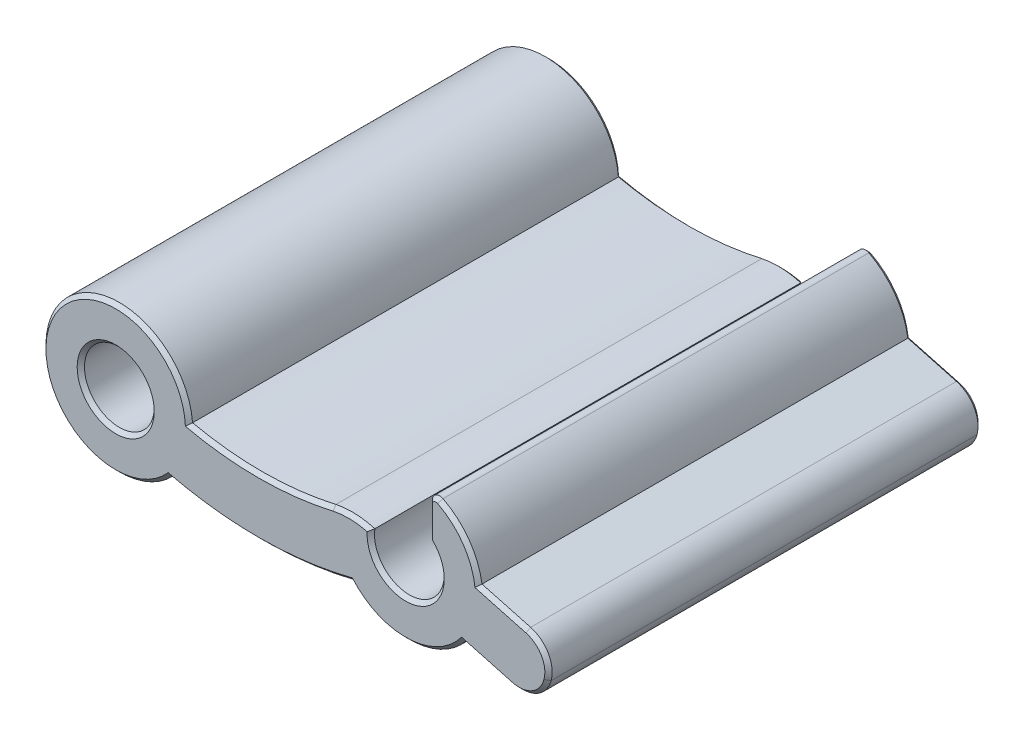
SolidWorks part; units mm, degrees
ref_plane "Front Plane" through (0, 0, 0) normal (0, 0, 1) x (1, 0, 0)
ref_plane "Top Plane" through (0, 0, 0) normal (0, 1, 0) x (1, 0, 0)
ref_plane "Right Plane" through (0, 0, 0) normal (1, 0, 0) x (0, 0, -1)
sketch "Sketch1" plane through (66.41, 0, 0) normal (0, 0, -1) x (-1, 0, 0)
  line L5 (-7.9984, -91.5648) -> (-15.7213, -93.652) construction
  line L6 (-15.7213, -93.652) -> (-11.8598, -92.6084) construction
  line L7 (-13.7689, -94.7818) -> (-11.12, -94.0659)
  line L8 (-14.6038, -91.6926) -> (-11.9549, -90.9767)
  line L9 (-16.1387, -92.1074) -> (-12.2773, -91.0638) construction
  line L10 (-15.3039, -95.1966) -> (-11.4424, -94.153) construction
  line L11 (-15.7239, -93.6424) -> (-15.7187, -93.6617)
  line L13 (-9.2484, -87.7651) -> (-9.2484, -90.1339)
  circle A0 centre (7.8016, -91.5648) radius 1.9
  arc A1 (4.876, -94.2925) -> (3.8139, -91.2524) centre (7.8016, -91.5648) ccw
  arc A2 (-9.2484, -90.1339) -> (-6.1196, -91.2818) centre (-7.9984, -91.5648) ccw
  arc A3 (-9.2484, -87.7651) -> (-11.9549, -90.9767) centre (-7.9984, -91.5648) ccw
  arc A4 (-5.3764, -92.4925) -> (4.7016, -92.6885) centre (0.0279, -73.8159) ccw construction
  arc A5 (-5.0269, -94.2425) -> (4.876, -94.2925) centre (0.0279, -73.8159) ccw
  arc A6 (-3.9984, -91.1984) -> (3.8139, -91.2524) centre (0.0279, -73.8159) ccw
  arc A7 (-4.9316, -90.9555) -> (4.317, -91.1355) centre (0.0279, -73.8159) ccw construction
  arc A8 (-5.8211, -94.0294) -> (5.0862, -94.2416) centre (0.0279, -73.8159) ccw construction
  arc A9 (-13.7689, -94.7818) -> (-15.7187, -93.6617) centre (-14.1838, -93.2468) cw
  arc A10 (-14.6038, -91.6926) -> (-15.7239, -93.6424) centre (-14.189, -93.2275) ccw
  arc A11 (-11.12, -94.0659) -> (-5.0269, -94.2425) centre (-7.9984, -91.5648) ccw
  arc A12 (-6.1196, -91.2818) -> (-3.9984, -91.1984) centre (-4.8924, -95.4785) cw
  dimension "D1" = 3.8
  dimension "D2" = 8
  dimension "D3" = 3.8
  dimension "D4" = 8
  dimension "D9" = 1.59
  dimension "D10" = 4.3724
  dimension "D5" = 1.6
  dimension "D11" = 4
  dimension "D12" = 15.8
  dimension "D13" = 105.124
  dimension "D14" = 8
  dimension "D15" = 1.25
  dimension "D16" = 122.574
  dimension "D6" = 1.6
  dimension "D7" = 1.6
  dimension "D8" = 1.6
extrude "Boss-Extrude1" add sketch "Sketch1" along normal blind 23.6 separate body
fillet "Fillet1" radius 0.4 1 edges at (75.6584, -87.7651, -11.8)
chamfer "Chamfer1" distance 0.2 angle 45 30 edges at (78.8545, -94.4238, 0) (81.3858, -94.6255, 0) (82.1313, -93.652, 0) (81.9777, -92.4355, 0) (79.6894, -91.3347, 0) (77.6613, -89.237, 0) (75.8502, -88.0236, 0) (75.6584, -89.2496, 0) (74.5243, -95.5631, 0) (75.0628, -93.3486, 0) (71.4741, -91.1095, 0) (66.4884, -94.8584, 0) (66.5053, -91.6582, 0) (54.8322, -90.2456, 0) (56.7084, -91.5648, 0) (56.7084, -91.5648, -23.6) (75.6584, -89.2496, -23.6) (75.8502, -88.0236, -23.6) (77.6613, -89.237, -23.6) (79.6894, -91.3347, -23.6) (81.9777, -92.4355, -23.6) (82.1313, -93.652, -23.6) (81.3858, -94.6255, -23.6) (75.0628, -93.3486, -23.6) (71.4741, -91.1095, -23.6) (78.8545, -94.4238, -23.6) (74.5243, -95.5631, -23.6) (66.4884, -94.8584, -23.6) (54.8322, -90.2456, -23.6) (66.5053, -91.6582, -23.6)
